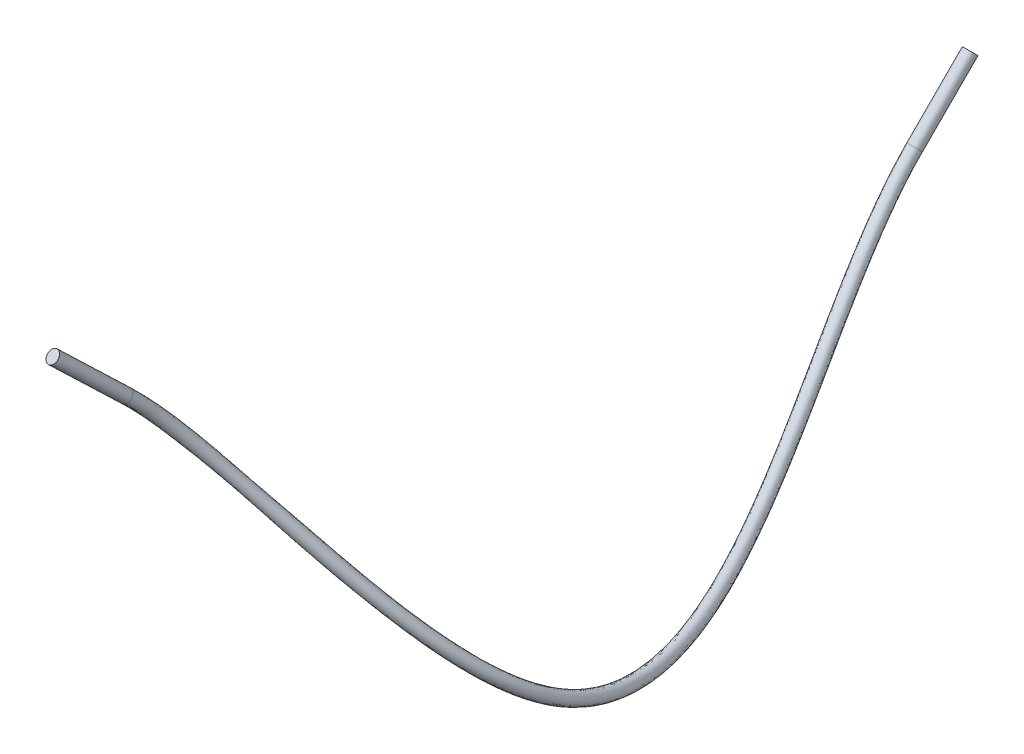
SolidWorks part; units mm, degrees
ref_plane "Front Plane" through (0, 0, 0) normal (0, 0, 1) x (1, 0, 0)
ref_plane "Top Plane" through (0, 0, 0) normal (0, 1, 0) x (1, 0, 0)
ref_plane "Right Plane" through (0, 0, 0) normal (1, 0, 0) x (0, 0, -1)
sketch3d "3DSketch1"
  line L0 (-0.746, 106.6696, 261.4213) -> (1.5521, 99.9732, 254.3482) construction
  line L1 (3.4925, 86.1799, 148.7701) -> (3.4925, 79.1035, 155.8465) construction
  line L2 (-0.746, 106.6696, 261.4213) -> (1.5521, 99.9732, 254.3482)
  line L3 (3.4925, 86.1799, 148.7701) -> (3.4925, 79.1035, 155.8465)
  spline S0 degree 3 poles (13350.3975, -6917.1818, 5579.6223) (-1037.734, 799.6143, -76.4653) (1252.4276, -685.9336, 822.6684) (-1377.2948, 811.8603, -771.5395) (13438.7836, -1888.9229, 8585.1394) knots -2.824369 -2.824369 -2.824369 -2.824369 0.400982 4.303702 4.303702 4.303702 4.303702 only from (1.5521, 99.9732, 254.3482) to (3.4925, 79.1035, 155.8465) construction
  spline S1 degree 3 poles (1.5521, 99.9732, 254.3482) (4.7157, 90.7552, 244.6117) (52.5192, 48.1837, 232.1528) (3.4925, 64.3285, 170.6215) (3.4925, 79.1035, 155.8465) knots 0 0 0 0 0.400982 1 1 1 1
ref_plane "Plane1" through (-0.746, 106.6696, 261.4213) normal (0.2296, -0.6691, -0.7068) x (-0.9733, -0.1579, -0.1668)
sketch "PipeSketch" plane through (-0.746, 106.6696, 261.4213) normal (0.2296, -0.6691, -0.7068) x (-0.9733, -0.1579, -0.1668)
  circle A0 centre (0, 0) radius 0.813
  dimension "OuterDiameter" = 1.626
sweep "Cable_1" add profiles "PipeSketch" path "3DSketch1"
